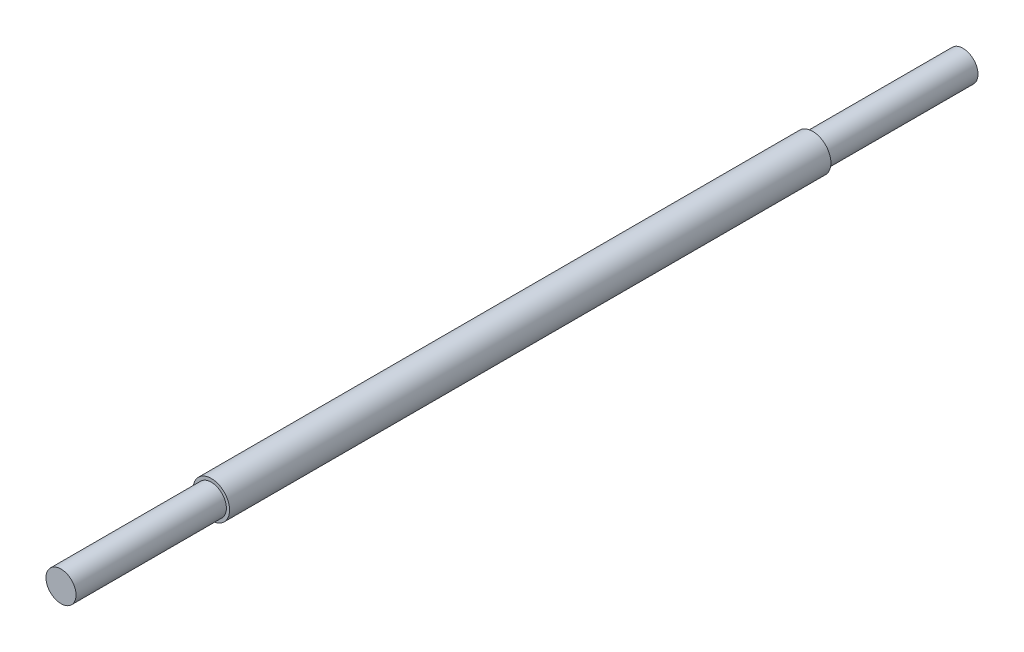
SolidWorks part; units mm, degrees
ref_plane "Plane1" through (0, 0, 0) normal (0, 0, 1) x (1, 0, 0)
ref_plane "Plane2" through (0, 0, 0) normal (0, 1, 0) x (1, 0, 0)
ref_plane "Plane3" through (0, 0, 0) normal (1, 0, 0) x (0, 0, -1)
sketch "Sketch1" plane through (0, 0, 0) normal (0, 0, 1) x (1, 0, 0)
  circle A0 centre (0, 0) radius 42.5
  dimension "D1" = 85
extrude "Base-Extrude" add sketch "Sketch1" along normal mid plane 1400
sketch "Sketch2" plane through (0, 0, 0) normal (0, 0, 1) x (1, 0, 0)
  circle A0 centre (0, 0) radius 35
  circle A1 centre (0, 0) radius 42.5 construction
  dimension "D1" = 70
extrude "Boss-Extrude1" add sketch "Sketch2" along normal mid plane 2100
